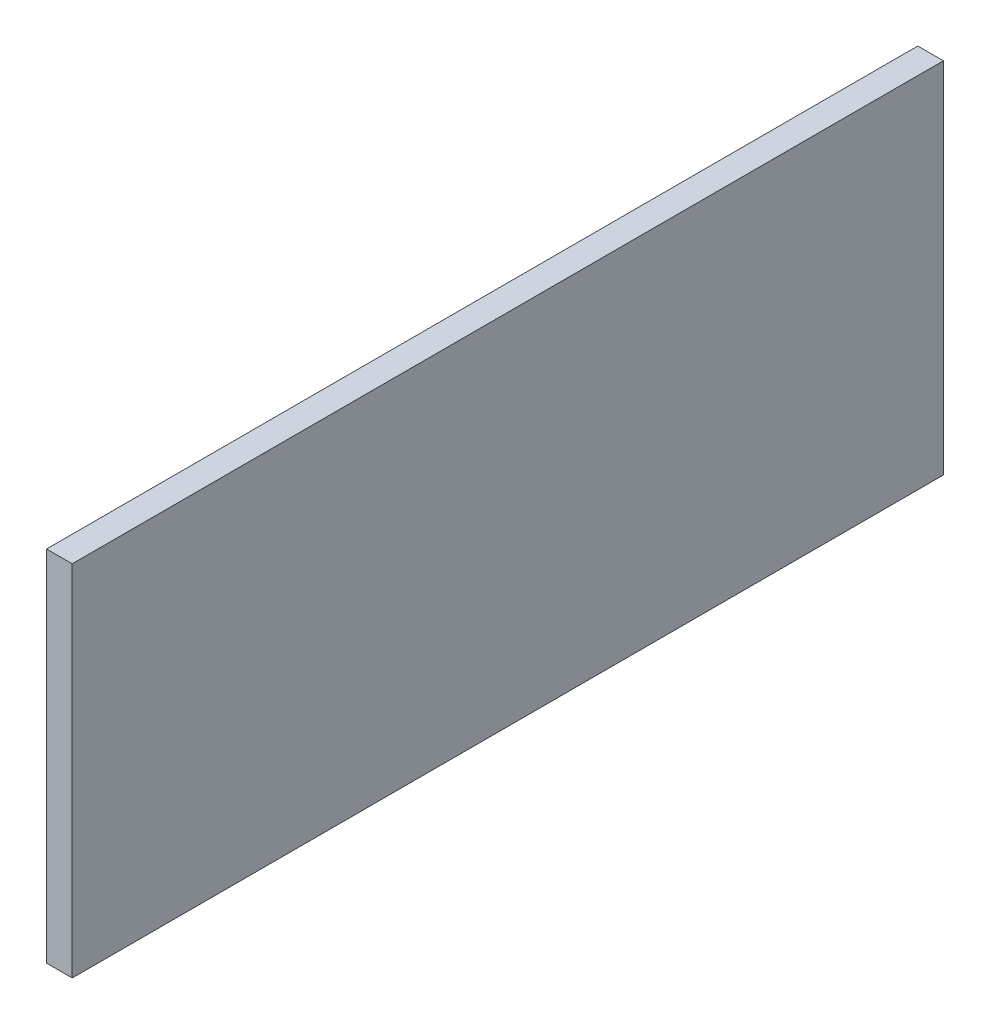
SolidWorks part; units mm, degrees
ref_plane "Front Plane" through (0, 0, 0) normal (0, 0, 1) x (1, 0, 0)
ref_plane "Top Plane" through (0, 0, 0) normal (0, 1, 0) x (1, 0, 0)
ref_plane "Right Plane" through (0, 0, 0) normal (1, 0, 0) x (0, 0, -1)
sketch "Sketch3" plane through (0, 0, 0) normal (0, 1, 0) x (1, 0, 0)
  line L0 (0, 863.6) -> (25.4, 863.6) construction
  line L1 (0, 0) -> (25.4, 0)
  line L2 (0, 0) -> (0, 863.6)
  line L4 (25.4, 0) -> (25.4, 863.6)
  line L5 (0, 863.6) -> (25.4, 863.6)
extrude "Boss-Extrude1" add sketch "Sketch3" along normal blind 355.6
equation "\"system_width\"= 7ft + 10 "
equation "\"system_length\"= 95.5"
equation "\"module_board_length\"= 11.25in"
equation "\"module_board_width\"= 1.5in"
equation "\"module_width\"= (\"system_width\" -  2* \"module_trim_thickness\") / 2"
equation "\"module_board_short_depth\"= \"module_width\" - ( 2 * \"module_board_width\" ) - \"module_lip_width\""
equation "\"module_board_hole\"= 0.5in"
equation "\"module_board_hole_seperation\"= 20in"
equation "\"system_step_width\"= 3ft"
equation "\"system_top_length\"= \"system_length\" - \"system_step_length\""
equation "\"module_top_thickness\"= 0.75in"
equation "\"module_lip_width\"= 1.5in"
equation "\"module_trim_thickness\"= 1in"
equation "\"module_trim_height\"= 14in"
equation "\"module_top_overhang\"= 4.5in"
equation "\"module_trim_angle\"= 45deg"
equation "\"module_length\"= (\"system_top_length\" - \"module_trim_thickness\")/ 2"
equation "\"module_board_long_depth\"= \"module_length\" - \"module_lip_width\""
equation "\"module_board_hole_position\"= ( ( \"module_width\" - \"module_board_hole_seperation\" ) / 2 ) + \"module_board_width\"/2"
equation "\"D1@Sketch3\"=\"module_length\"+\"module_top_overhang\""
equation "\"D2@Sketch3\"=\"module_trim_thickness\""
equation "\"step_board_length\"= 5.5in"
equation "\"step_board_width\"= 1.5in"
equation "\"system_step_length\"= 2ft+11.5"
equation "\"step_module_width\"= \"module_width\""
equation "\"step_module_length\"= \"system_step_length\" - \"module_trim_thickness\""
equation "\"step_board_short_depth\"= \"step_module_length\" - \"module_lip_width\""
equation "\"step_board_long_depth\"= \"step_module_width\" - (2 * \"module_board_width\") - \"module_lip_width\""
equation "\"step_trim_height\"= 8in"
